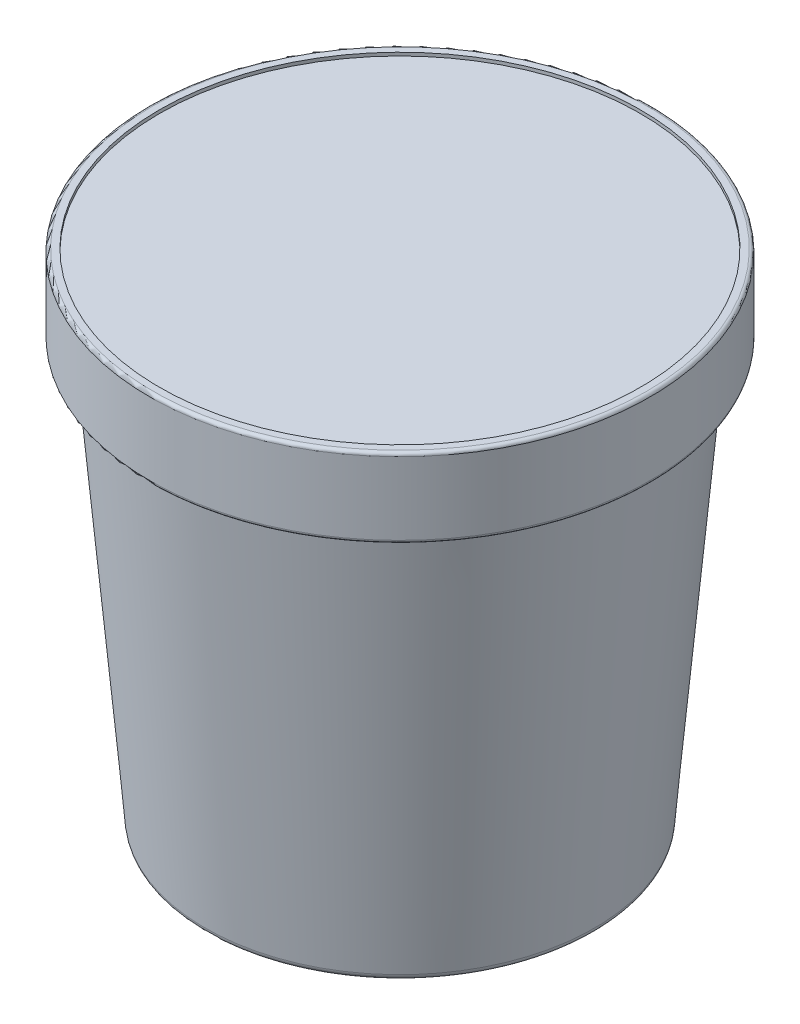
SolidWorks part; units mm, degrees
ref_plane "Front Plane" through (0, 0, 0) normal (0, 0, 1) x (1, 0, 0)
ref_plane "Top Plane" through (0, 0, 0) normal (0, 1, 0) x (1, 0, 0)
ref_plane "Right Plane" through (0, 0, 0) normal (1, 0, 0) x (0, 0, -1)
sketch "Sketch1" plane through (0, 0, 0) normal (0, 0, 1) x (1, 0, 0)
  line L2 (38, 75) -> (38, 64)
  line L3 (37.5, 63.5) -> (35, 63.5)
  line L4 (35, 63.5) -> (29.5243, 0.9128)
  line L5 (28.5281, 0) -> (0, 0)
  line L6 (37.5, 75.5) -> (36.5, 75.5)
  line L7 (36.5, 75.5) -> (36.5, 75)
  line L8 (36.5, 75) -> (0, 75)
  line L9 (0, 75) -> (0, 0)
  arc A0 (38, 64) -> (37.5, 63.5) centre (37.5, 64) cw
  arc A1 (37.5, 75.5) -> (38, 75) centre (37.5, 75) cw
  arc A2 (29.5243, 0.9128) -> (28.5281, 0) centre (28.5281, 1) cw
  point P9 (38, 63.5)
  dimension "D6" = 0.5
  dimension "D8" = 1
  dimension "D1" = 1
  dimension "D2" = 38
  dimension "D3" = 12
  dimension "D4" = 95
  dimension "D5" = 3
  dimension "D7" = 75
revolve "Revolve1" add sketch "Sketch1" angle 360 about L9
